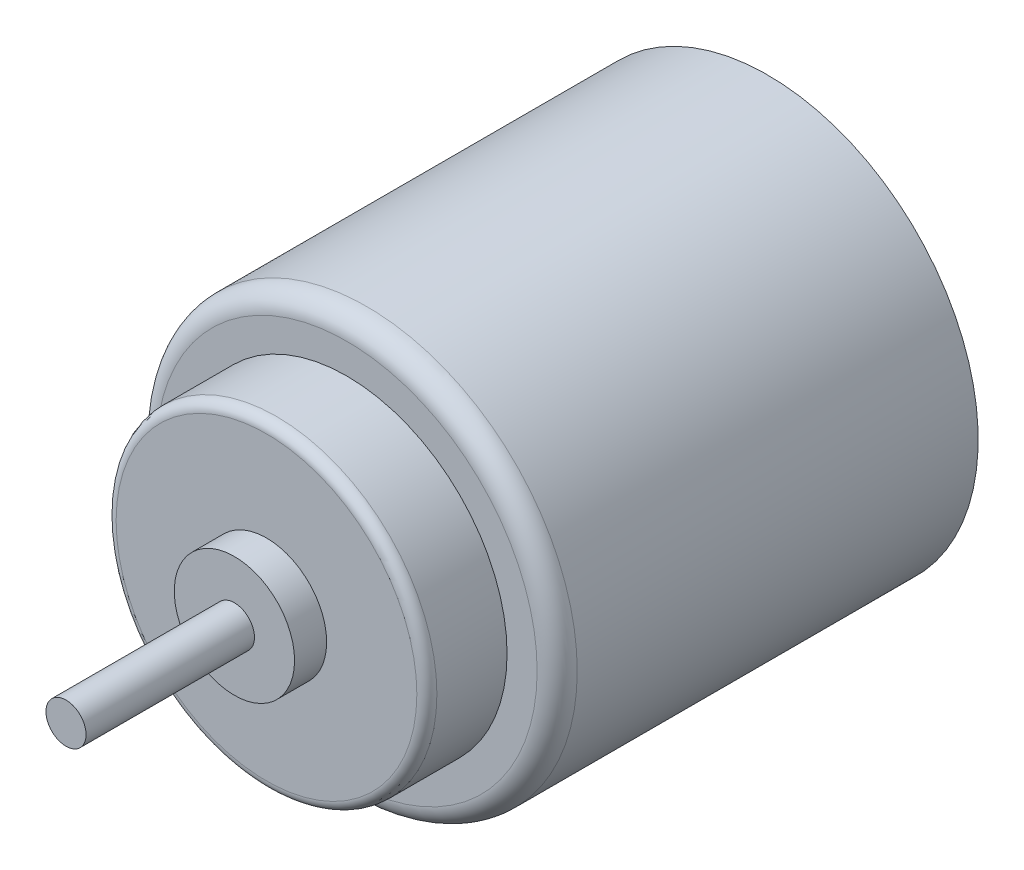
SolidWorks part; units mm, degrees
ref_plane "Alzado" through (0, 0, 0) normal (0, 0, 1) x (1, 0, 0)
ref_plane "Planta" through (0, 0, 0) normal (0, 1, 0) x (1, 0, 0)
ref_plane "Vista lateral" through (0, 0, 0) normal (1, 0, 0) x (0, 0, -1)
sketch "Croquis1" plane through (0, 0, 0) normal (0, 0, 1) x (1, 0, 0)
  circle A0 centre (0, 0) radius 10.5
  dimension "D1" = 21
extrude "Saliente-Extruir1" add sketch "Croquis1" along normal blind 21
sketch "Croquis2" plane through (0, 0, 21) normal (0, 0, 1) x (1, 0, 0)
  circle A0 centre (0, 0) radius 8
  dimension "D1" = 16
extrude "Saliente-Extruir2" add sketch "Croquis2" along normal blind 4
sketch "Croquis3" plane through (0, 0, 25) normal (0, 0, 1) x (1, 0, 0)
  circle A0 centre (0, 0) radius 3
  dimension "D1" = 6
extrude "Saliente-Extruir3" add sketch "Croquis3" along normal blind 1.6
sketch "Croquis4" plane through (0, 0, 26.6) normal (0, 0, 1) x (1, 0, 0)
  circle A0 centre (0, 0) radius 1
  dimension "D1" = 2
extrude "Saliente-Extruir4" add sketch "Croquis4" along normal blind 8.4
fillet "Redondeo1" radius 1 1 edges at (10.5, 0, 21)
fillet "Redondeo2" radius 0.5 1 edges at (8, 0, 25)
sketch "Croquis5" plane through (0, 0, 0) normal (0, 0, -1) x (-1, 0, 0)
  circle A0 centre (0, 0) radius 3
  dimension "D1" = 6
extrude "Saliente-Extruir5" add sketch "Croquis5" along normal blind 2
fillet "Redondeo3" radius 0.5 1 edges at (-3, 0, -2)
